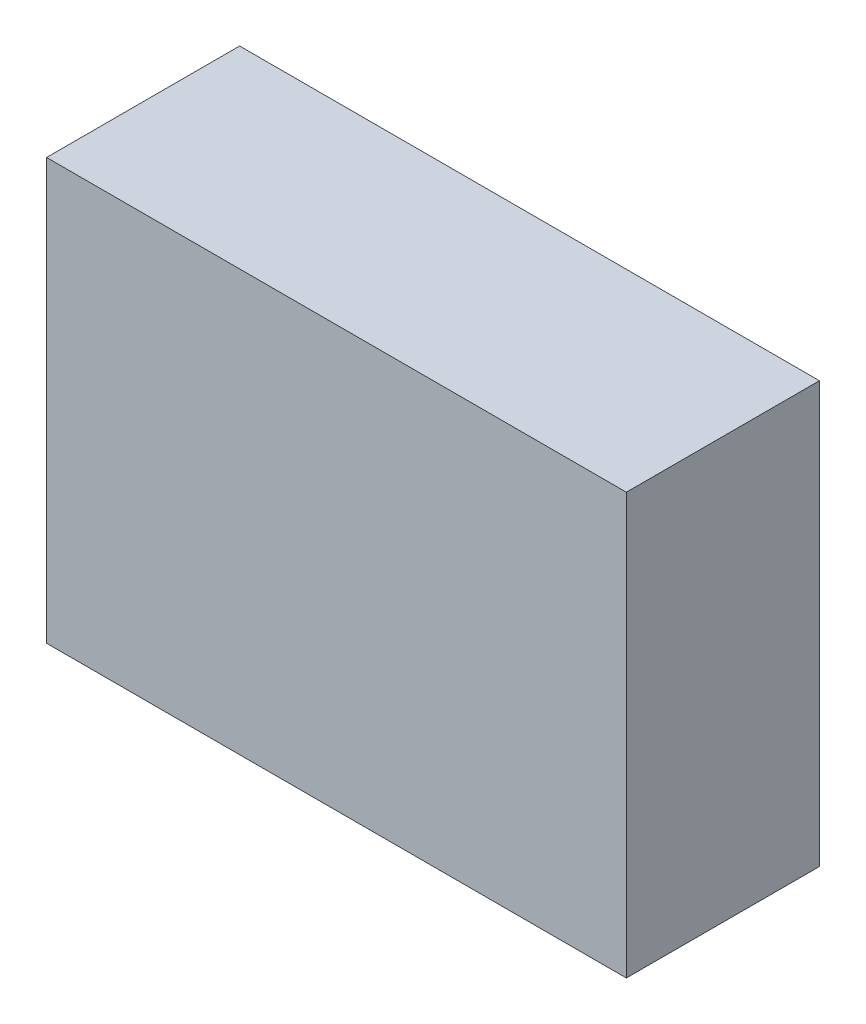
SolidWorks part; units mm, degrees
ref_plane "Front Plane" through (0, 0, 0) normal (0, 0, 1) x (1, 0, 0)
ref_plane "Top Plane" through (0, 0, 0) normal (0, 1, 0) x (1, 0, 0)
ref_plane "Right Plane" through (0, 0, 0) normal (1, 0, 0) x (0, 0, -1)
sketch "Sketch1" plane through (0, 0, 0) normal (0, 0, 1) x (1, 0, 0)
  line L1 (0, 0) -> (49.581, 0)
  line L2 (0, 0) -> (0, 35.978)
  line L3 (0, 35.978) -> (49.581, 35.978)
  line L4 (49.581, 0) -> (49.581, 35.978)
extrude "Extrude1" add sketch "Sketch1" along normal blind 16.51
